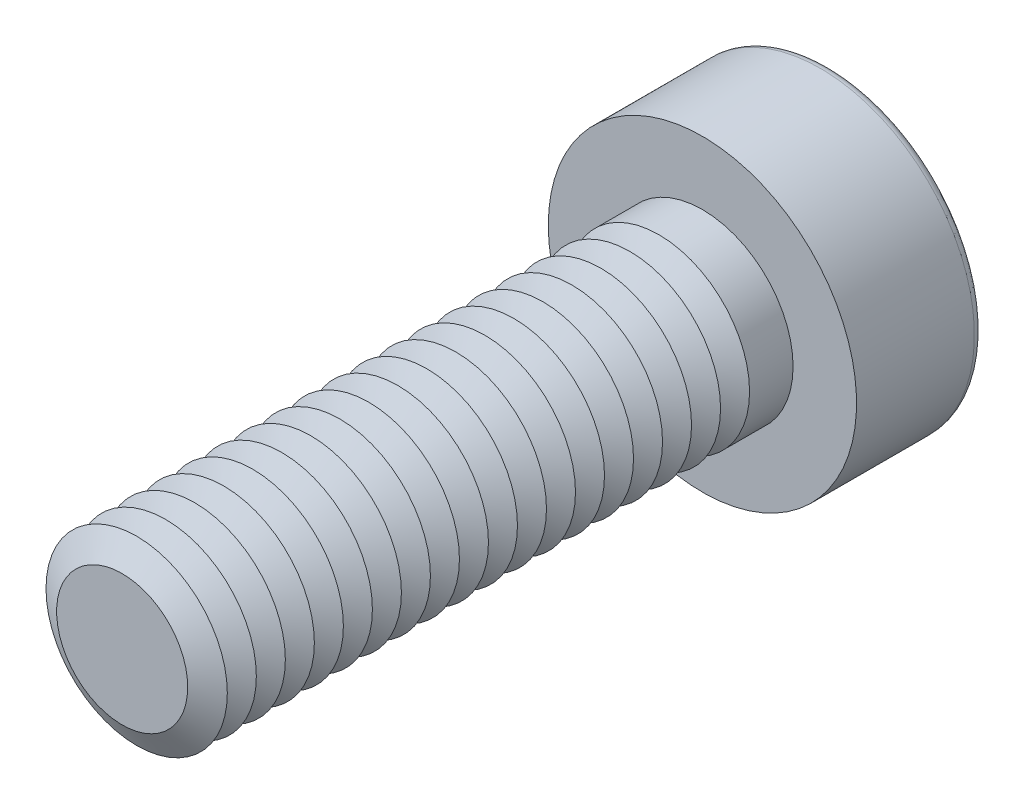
SolidWorks part; units mm, degrees
ref_plane "Front Plane" through (0, 0, 0) normal (0, 0, 1) x (1, 0, 0)
ref_plane "Top Plane" through (0, 0, 0) normal (0, 1, 0) x (1, 0, 0)
ref_plane "Right Plane" through (0, 0, 0) normal (1, 0, 0) x (0, 0, -1)
sketch "Sketch1" plane through (0, 0, 0) normal (0, 0, 1) x (1, 0, 0)
  circle A0 centre (0, 0) radius 2.5
  dimension "D1" = 5
extrude "Boss-Extrude1" add sketch "Sketch1" along normal blind 16
sketch "Sketch2" plane through (0, 0, 0) normal (0, 0, -1) x (-1, 0, 0)
  circle A0 centre (0, 0) radius 4.25
  dimension "D1" = 8.5
extrude "Boss-Extrude2" add sketch "Sketch2" along normal blind 3.5
sketch "Sketch3" plane through (0, 0, -3.5) normal (0, 0, -1) x (-1, 0, 0)
  line L1 (-0.866, 1.5) -> (-1.7321, 0)
  line L2 (-1.7321, 0) -> (-0.866, -1.5)
  line L3 (-0.866, -1.5) -> (0.866, -1.5)
  line L4 (0.866, -1.5) -> (1.7321, 0)
  line L5 (1.7321, 0) -> (0.866, 1.5)
  line L6 (0.866, 1.5) -> (-0.866, 1.5)
  circle A0 centre (0, 0) radius 1.5 construction
  dimension "D1" = 3
extrude "Cut-Extrude1" cut sketch "Sketch3" against normal blind 2.25
fillet "Fillet1" radius 0.25 1 edges at (-4.25, 0, -3.5)
sketch "Sketch4" plane through (0, 0, -1.25) normal (0, 0, -1) x (-1, 0, 0)
  line L0 (0.866, -1.5) -> (1.7321, 0) construction
  circle A0 centre (0, 0) radius 1.5
extrude "Cut-Extrude2" cut sketch "Sketch4" against normal through all draft 60
sketch "Sketch5" plane through (0, 0, -3.5) normal (0, 0, -1) x (-1, 0, 0)
  circle A0 centre (0, 0) radius 1.7321
extrude "Cut-Extrude3" cut sketch "Sketch5" against normal through all draft 75
sketch "Sketch7" plane through (0, 0, 0) normal (1, 0, 0) x (0, 0, -1)
  line L25 (-16, 1.8072) -> (-15.6, 2.5)
  line L26 (-16, 2.5) -> (-16, -2.5) construction
  line L27 (-15.6, 2.5) -> (-16.4, 2.5)
  line L28 (-16.4, 2.5) -> (-16, 1.8072)
  line L29 (0, 2.5) -> (-16, 2.5) construction
  dimension "D1" = 0.8
revolve "Cut-Revolve1" cut sketch "Sketch7" angle 360 about axis through (0, 0, 16) along (0, 0, -1)
pattern_linear "LPattern1" count 19 spacing 0.8 along (0, 0, -1) of "Cut-Revolve1"
